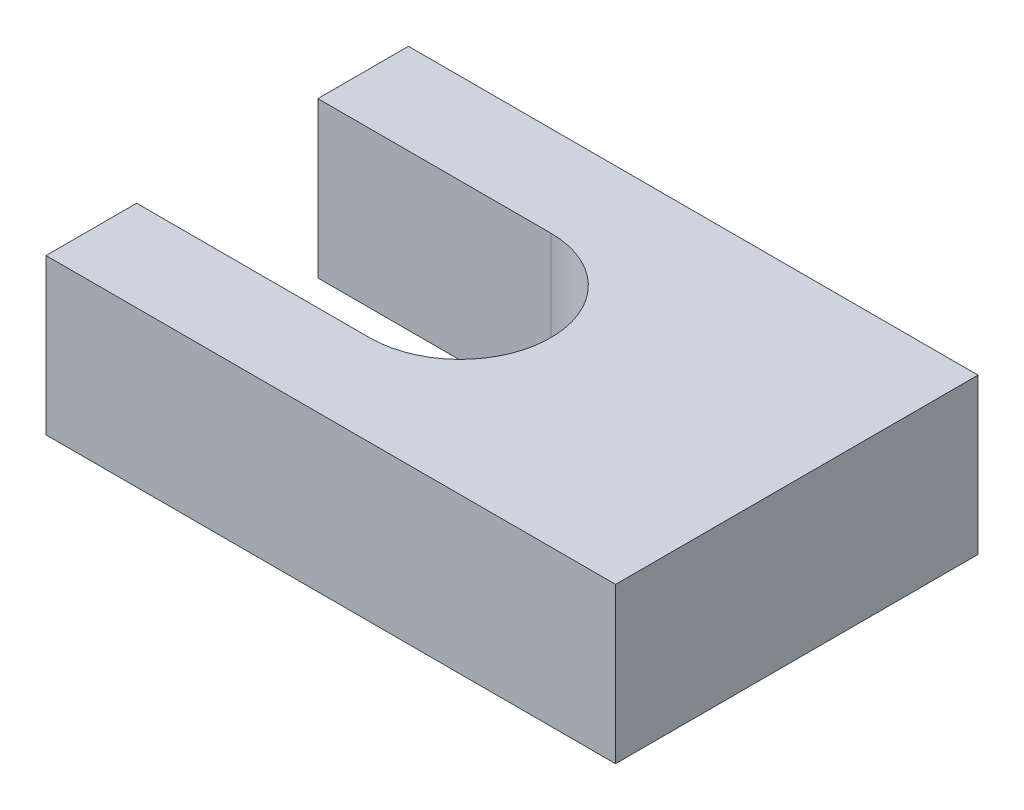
SolidWorks part; units mm, degrees
ref_plane "前视基准面" through (0, 0, 0) normal (0, 0, 1) x (1, 0, 0)
ref_plane "上视基准面" through (0, 0, 0) normal (0, 1, 0) x (1, 0, 0)
ref_plane "右视基准面" through (0, 0, 0) normal (1, 0, 0) x (0, 0, -1)
sketch "Sketch1" plane through (0, 0, 0) normal (0, 1, 0) x (1, 0, 0)
  line L0 (-69.85, 0) -> (71.0543, 0) construction
  line L1 (0, 17.5) -> (-45, 17.5)
  line L2 (-45, 17.5) -> (-45, 35)
  line L3 (-45, 35) -> (65, 35)
  line L4 (65, 35) -> (65, -35)
  line L5 (65, -35) -> (-45, -35)
  line L6 (-45, -35) -> (-45, -17.5)
  line L7 (-45, -17.5) -> (0, -17.5)
  arc A0 (0, -17.5) -> (0, 17.5) centre (0, 0) ccw
  dimension "D1" = 70
  dimension "D2" = 110
  dimension "D3" = 45
  dimension "D4" = 35
extrude "Extrude1" add sketch "Sketch1" along normal blind 30
